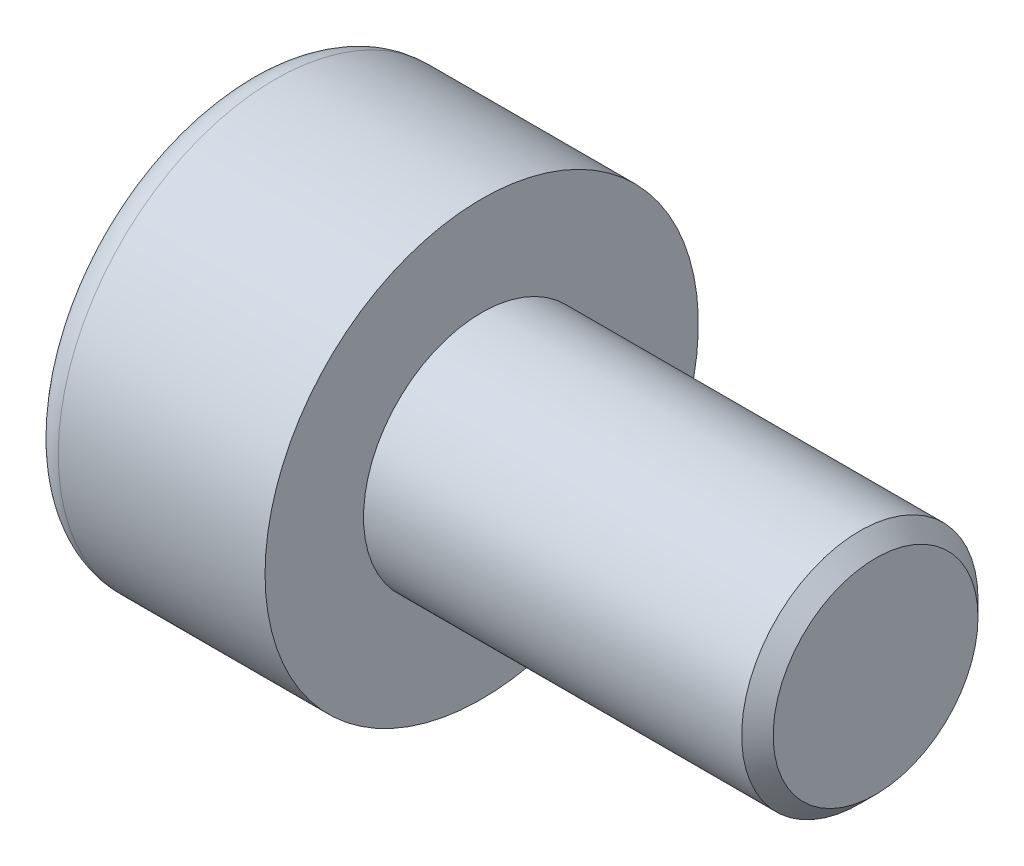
SolidWorks part; units mm, degrees
other "Chamfer1"
ref_plane "前视基准面" through (0, 0, 0) normal (0, 0, 1) x (1, 0, 0)
ref_plane "上视基准面" through (0, 0, 0) normal (0, 1, 0) x (1, 0, 0)
ref_plane "右视基准面" through (0, 0, 0) normal (1, 0, 0) x (0, 0, -1)
imported_body "输入1"
sketch "草图1" plane through (3, 0, 0) normal (1, 0, 0) x (0, 0, -1)
  circle A0 centre (0, 0) radius 1.5
  dimension "D1" = 3
extrude "凸台-拉伸1" add sketch "草图1" along normal blind 5
chamfer "倒角1" distance 0.2 angle 45 1 edges at (8, 0, -1.5)
